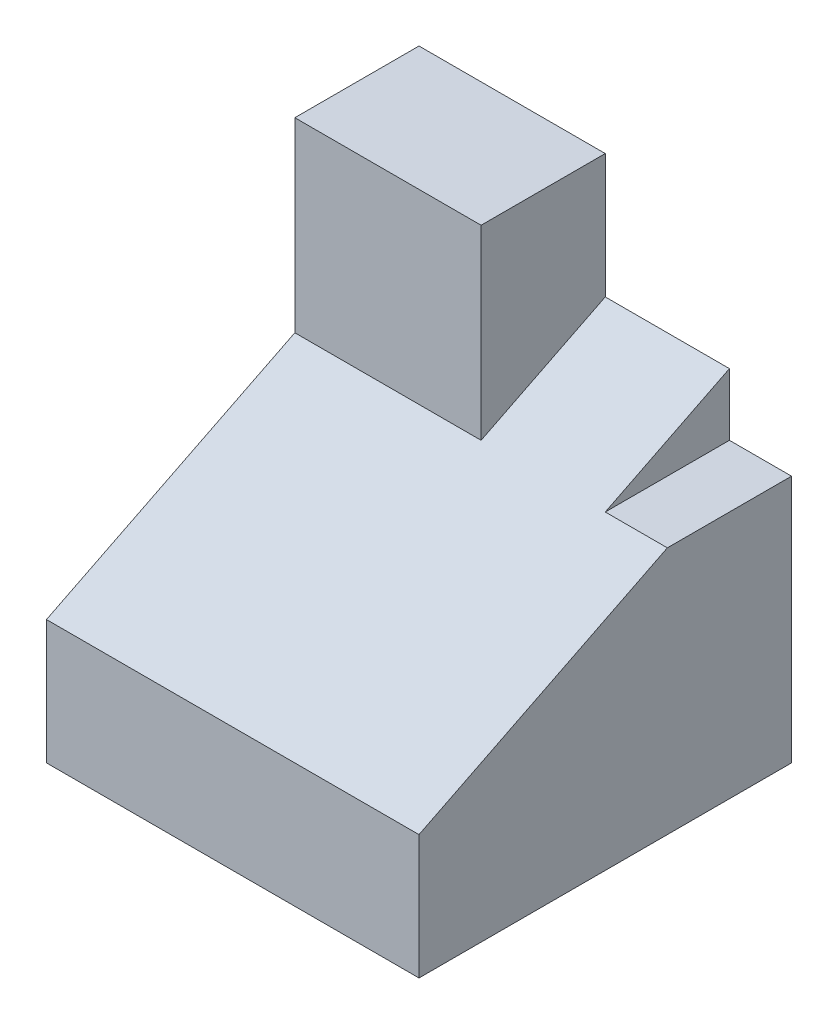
SolidWorks part; units mm, degrees
ref_plane "Alzado" through (0, 0, 0) normal (0, 0, 1) x (1, 0, 0)
ref_plane "Planta" through (0, 0, 0) normal (0, 1, 0) x (1, 0, 0)
ref_plane "Vista lateral" through (0, 0, 0) normal (1, 0, 0) x (0, 0, -1)
sketch "Croquis1" plane through (0, 0, 0) normal (0, 0, 1) x (1, 0, 0)
  line L0 (30, 35) -> (-30, -35) construction
  line L1 (-30, 35) -> (30, 35)
  line L2 (-30, 35) -> (-30, -35)
  line L3 (-30, -35) -> (30, -35)
  line L4 (30, 35) -> (30, -35)
  line L5 (30, -35) -> (-30, 35) construction
  dimension "D1" = 70
  dimension "D2" = 60
extrude "Saliente-Extruir1" add sketch "Croquis1" along normal mid plane 60
sketch "Croquis2" plane through (30, 0, 0) normal (1, 0, 0) x (0, 0, -1)
  line L0 (10, 35) -> (10, 5)
  line L1 (-30, 35) -> (30, 35) construction
  line L2 (10, 5) -> (-30, -15)
  line L3 (-30, -35) -> (-30, 35) construction
  line L4 (-30, -15) -> (-30, 35)
  line L5 (-30, 35) -> (10, 35)
  line L6 (-30, -35) -> (30, -35) construction
  line L7 (30, -35) -> (30, 35) construction
  dimension "D1" = 20
  dimension "D2" = 20
  dimension "D3" = 30
extrude "Cortar-Extruir1" cut sketch "Croquis2" against normal through all
sketch "Croquis3" plane through (30, 0, 0) normal (1, 0, 0) x (0, 0, -1)
  line L0 (10, 5) -> (30, 15)
  line L1 (30, -35) -> (30, 35) construction
  line L2 (30, 15) -> (30, 35)
  line L3 (30, 35) -> (10, 35)
  line L4 (10, 35) -> (10, 5)
  line L5 (-30, -15) -> (10, 5) construction
extrude "Cortar-Extruir2" cut sketch "Croquis3" against normal offset from surface (30 mm away) 30
sketch "Croquis4" plane through (30, 0, 0) normal (1, 0, 0) x (0, 0, -1)
  line L0 (30, 15) -> (10, 5)
  line L1 (-30, -15) -> (30, 15) construction
  line L2 (10, 5) -> (30, 5)
  line L3 (30, -35) -> (30, 15) construction
  line L4 (30, 5) -> (30, 15)
  dimension "D1" = 10
extrude "Cortar-Extruir3" cut sketch "Croquis4" against normal blind 10
